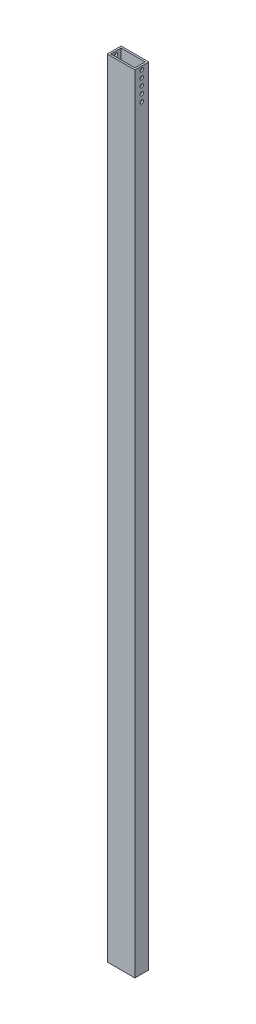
SolidWorks part; units mm, degrees
ref_plane "Front" through (0, 0, 0) normal (0, 0, 1) x (1, 0, 0)
ref_plane "Top" through (0, 0, 0) normal (0, 1, 0) x (1, 0, 0)
ref_plane "Right" through (0, 0, 0) normal (1, 0, 0) x (0, 0, -1)
sketch "Sketch1" plane through (0, 0, 0) normal (0, 1, 0) x (1, 0, 0)
  line L0 (-22.225, 9.525) -> (-22.225, 12.7) construction
  line L1 (25.4, -12.7) -> (-25.4, -12.7)
  line L2 (25.4, -12.7) -> (25.4, 12.7)
  line L3 (25.4, 12.7) -> (-25.4, 12.7)
  line L4 (-25.4, -12.7) -> (-25.4, 12.7)
  line L5 (25.4, -12.7) -> (-25.4, 12.7) construction
  line L6 (25.4, 12.7) -> (-25.4, -12.7) construction
  line L7 (22.225, -9.525) -> (-22.225, -9.525)
  line L8 (22.225, -9.525) -> (22.225, 9.525)
  line L9 (22.225, 9.525) -> (-22.225, 9.525)
  line L10 (-22.225, -9.525) -> (-22.225, 9.525)
  line L11 (22.225, -9.525) -> (-22.225, 9.525) construction
  line L12 (22.225, 9.525) -> (-22.225, -9.525) construction
  line L13 (-22.225, 9.525) -> (-25.4, 9.525) construction
  point P0 (0, 0)
  point P5 (0, 0)
  dimension "D1" = 3.175
  dimension "D2" = 25.4
  dimension "D3" = 50.8
extrude "Boss-Extrude1" add sketch "Sketch1" along normal blind 1447.8
sketch "Sketch2" plane through (25.4, 0, 0) normal (1, 0, 0) x (0, 0, -1)
  line L0 (-12.7, 1447.8) -> (12.7, 1447.8) construction
  circle A0 centre (0, 1441.45) radius 3.175
  dimension "D1" = 6.35
  dimension "D2" = 6.35
extrude "Cut-Extrude1" cut sketch "Sketch2" against normal through all
pattern_linear "LPattern1" count 5 spacing 12.7 along (0, -1, 0) of "Cut-Extrude1"
sketch "Sketch3" plane through (0, 0, -12.7) normal (0, 0, -1) x (-1, 0, 0)
  circle A0 centre (-13.1519, 758.8313) radius 3.175 construction
  circle A1 centre (-13.1519, 746.1313) radius 3.175 construction
  circle A2 centre (-13.1519, 733.4313) radius 3.175 construction
  circle A3 centre (-13.1519, 720.7313) radius 3.175 construction
  circle A4 centre (-13.1519, 708.0313) radius 3.175 construction
  circle A5 centre (-13.1519, 758.8313) radius 3.175
  circle A6 centre (-13.1519, 746.1313) radius 3.175
  circle A7 centre (-13.1519, 733.4313) radius 3.175
  circle A8 centre (-13.1519, 720.7313) radius 3.175
  circle A9 centre (-13.1519, 708.0313) radius 3.175
extrude "Cut-Extrude2" cut sketch "Sketch3" against normal up to next
